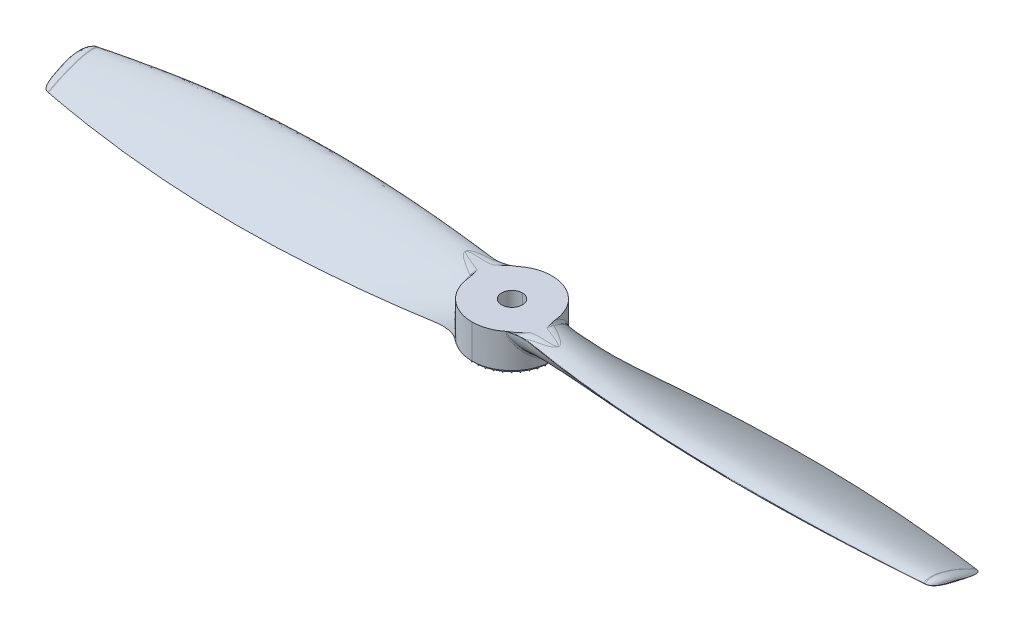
SolidWorks part; units mm, degrees
other "<1160_PROPELLER>-<helice  28-15.STEP>"
ref_plane "Front Plane" through (0, 0, 0) normal (0, 0, 1) x (1, 0, 0)
ref_plane "Top Plane" through (0, 0, 0) normal (0, 1, 0) x (1, 0, 0)
ref_plane "Right Plane" through (0, 0, 0) normal (1, 0, 0) x (0, 0, -1)
mirrored part "1160_PROPELLER_Mirrored"
